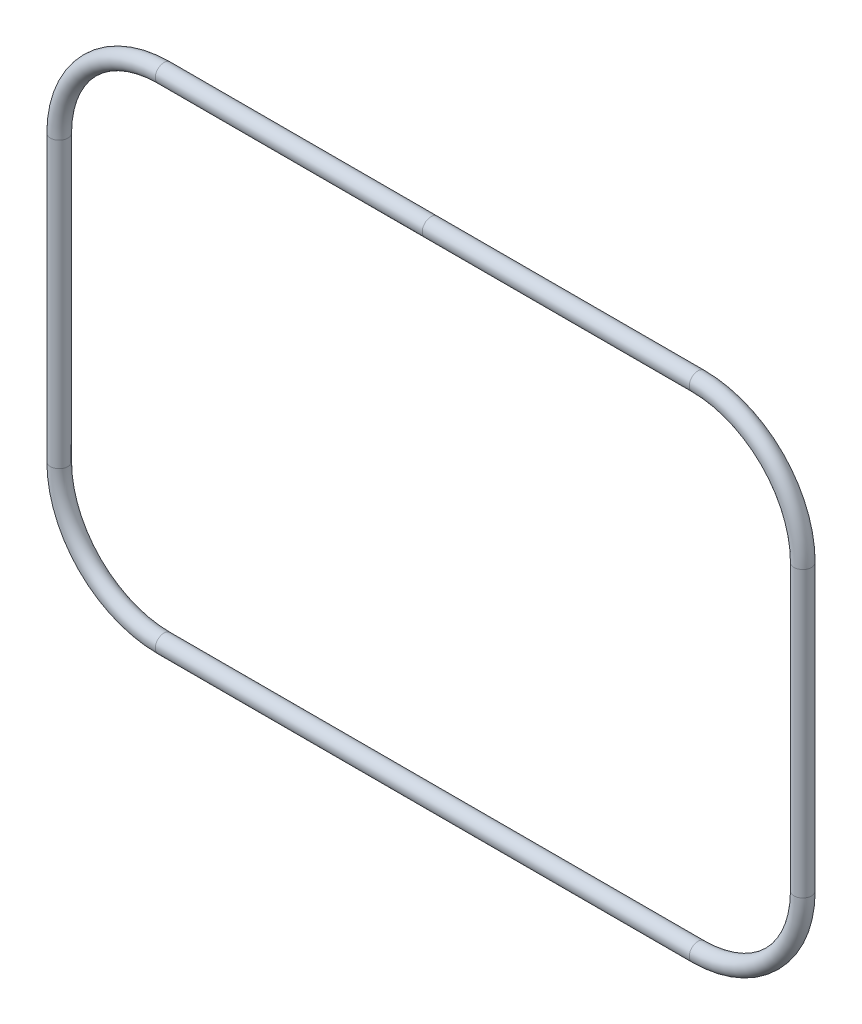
SolidWorks part; units mm, degrees
ref_plane "Front" through (0, 0, 0) normal (0, 0, 1) x (1, 0, 0)
ref_plane "Top" through (0, 0, 0) normal (0, 1, 0) x (1, 0, 0)
ref_plane "Right" through (0, 0, 0) normal (1, 0, 0) x (0, 0, -1)
sketch "Sketch1" plane through (0, 0, 0) normal (0, 0, 1) x (1, 0, 0)
  line L1 (-27.178, -24.892) -> (27.178, -24.892)
  line L2 (-37.592, -14.478) -> (-37.592, 14.478)
  line L3 (-27.178, 24.892) -> (27.178, 24.892)
  line L4 (37.592, -14.478) -> (37.592, 14.478)
  line L5 (-37.592, -24.892) -> (37.592, 24.892) construction
  line L6 (-37.592, 24.892) -> (37.592, -24.892) construction
  arc A0 (-27.178, -24.892) -> (-37.592, -14.478) centre (-27.178, -14.478) cw
  arc A1 (27.178, -24.892) -> (37.592, -14.478) centre (27.178, -14.478) ccw
  arc A2 (27.178, 24.892) -> (37.592, 14.478) centre (27.178, 14.478) cw
  arc A3 (-37.592, 14.478) -> (-27.178, 24.892) centre (-27.178, 14.478) cw
  point P0 (0, 0)
  dimension "D1" = 10.414
  dimension "D2" = 49.784
  dimension "D3" = 75.184
sketch "Sketch2" plane through (0, 0, 0) normal (1, 0, 0) x (0, 0, -1)
  circle A0 centre (0, 25.146) radius 0.889
  dimension "D2" = 1.778
  dimension "D1" = 25.146
sweep "Sweep1" add profiles "Sketch2" path "Sketch1"
